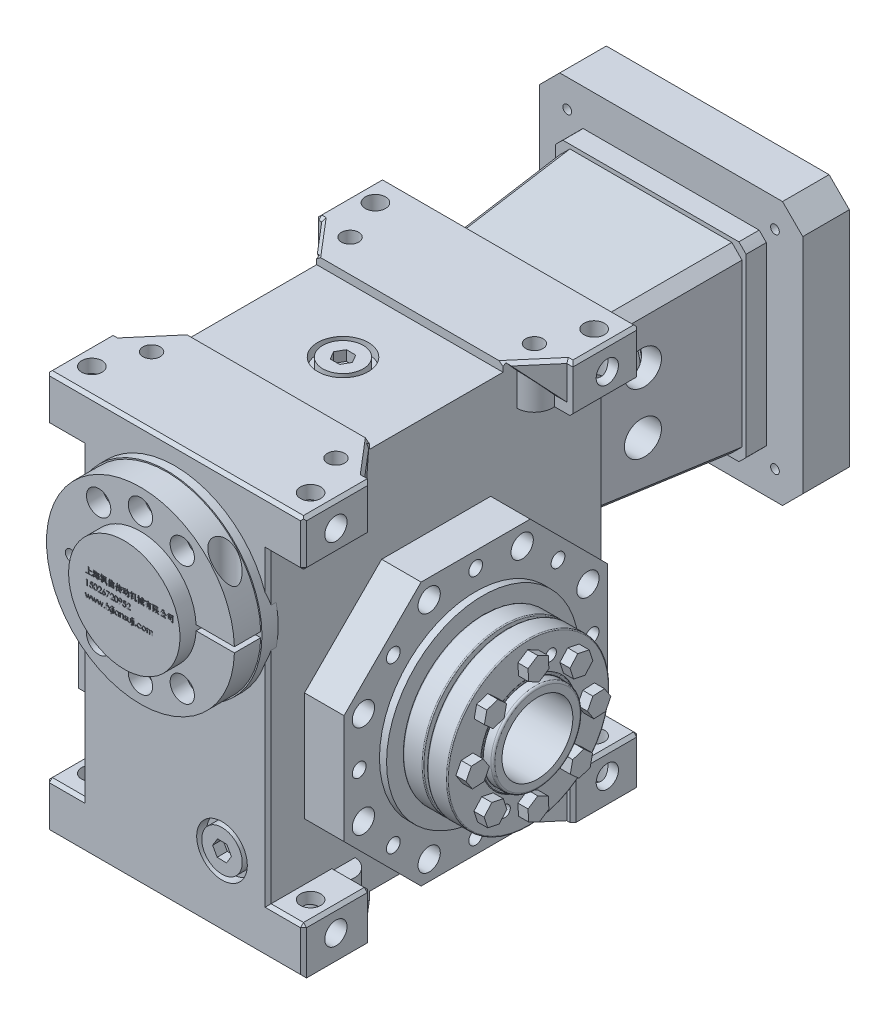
SolidWorks part; units mm, degrees
ref_plane "前视基准面" through (0, 0, 0) normal (0, 0, 1) x (1, 0, 0)
ref_plane "上视基准面" through (0, 0, 0) normal (0, 1, 0) x (1, 0, 0)
ref_plane "右视基准面" through (0, 0, 0) normal (1, 0, 0) x (0, 0, -1)
imported_body "JDLB063-CR箱体-1-solid1"
imported_body "JDLB063-CR箱体-1-solid2"
imported_body "JDLB063-2C空心轴Φ35-1-solid1"
imported_body "JDLB063-ST94输入法兰-1-solid1"
imported_body "ST130-110-145-M8伺服法兰接口-1-solid1"
imported_body "联轴器BD56-60-20-22锁紧-2-solid1"
imported_body "联轴器BD56-60-20-22锁紧-2-solid2"
imported_body "联轴器BD56-60-20-22锁紧-2-solid3"
imported_body "联轴器BD56-60-20-22锁紧-2-solid4"
imported_body "联轴器BD56-60-20-22锁紧-2-solid5"
imported_body "联轴器BD56-60-20-22锁紧-2-solid6"
imported_body "联轴器BD56-60-20-22锁紧-2-solid7"
imported_body "联轴器BD56-60-20-22锁紧-2-solid8"
imported_body "联轴器BD56-60-20-22锁紧-2-solid9"
imported_body "联轴器BD56-60-20-22锁紧-2-solid10"
imported_body "联轴器BD56-60-20-22锁紧-2-solid11"
imported_body "JDLB063-C1锁紧盘-44-80-25-1-solid1"
imported_body "JDLB063-C1锁紧盘-44-80-25-1-solid2"
imported_body "JDLB063-C1锁紧盘-44-80-25-1-solid3"
imported_body "JDLB063-C1锁紧盘-44-80-25-2-solid1"
imported_body "JDLB063-C1锁紧盘-44-80-25-2-solid2"
imported_body "JDLB063-C1锁紧盘-44-80-25-2-solid3"
sketch "草图1" plane through (47, 0, 0) normal (1, 0, 0) x (0, 0, -1)
  line L1 (-33.0126, 100.9789) -> (34.4389, 100.9789)
  line L2 (-33.0126, 100.9789) -> (-33.0126, 86.8823)
  line L3 (-33.0126, 86.8823) -> (34.4389, 86.8823)
  line L4 (34.4389, 100.9789) -> (34.4389, 86.8823)
extrude "切除-拉伸1" cut sketch "草图1" against normal up to surface (1 mm away)
sketch "草图2" plane through (-47, 0, 0) normal (-1, 0, 0) x (0, 0, 1)
  line L1 (-25.0071, 100.1318) -> (24.3008, 100.1318)
  line L2 (-25.0071, 100.1318) -> (-25.0071, 87.1656)
  line L3 (-25.0071, 87.1656) -> (24.3008, 87.1656)
  line L4 (24.3008, 100.1318) -> (24.3008, 87.1656)
extrude "切除-拉伸2" cut sketch "草图2" against normal up to surface (1 mm away)
sketch "草图3" plane through (0, 0, 108) normal (0, 0, 1) x (1, 0, 0)
  text T0 "上海枫信传动机械有限公司  15026720952  www.fxjiansuji.com" font "Century Gothic" height in points 10
extrude "凸台-拉伸1" add sketch "草图3" along normal blind 0.2
